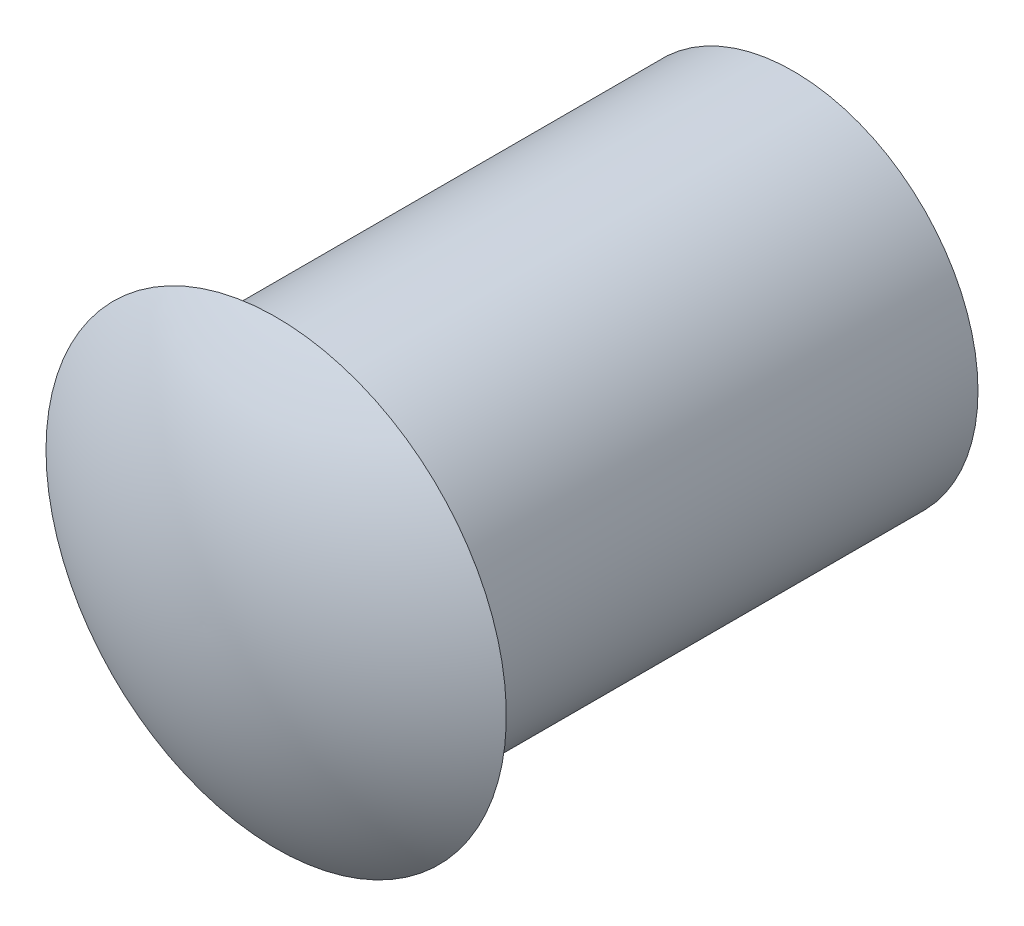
SolidWorks part; units mm, degrees
ref_plane "Front Plane" through (0, 0, 0) normal (0, 0, 1) x (1, 0, 0)
ref_plane "Top Plane" through (0, 0, 0) normal (0, 1, 0) x (1, 0, 0)
ref_plane "Right Plane" through (0, 0, 0) normal (1, 0, 0) x (0, 0, -1)
sketch "Sketch1" plane through (0, 0, 0) normal (0, 0, 1) x (1, 0, 0)
  circle A0 centre (0, 0) radius 2.9925
extrude "Boss-Extrude1" add sketch "Sketch1" against normal blind 8.382
sketch "Sketch2" plane through (0, 0, 0) normal (0, 1, 0) x (1, 0, 0)
  line L0 (-3.7303, 0) -> (0, 0)
  line L1 (0, 0) -> (0, -1.1808)
  arc A0 (0, -1.1808) -> (-3.7303, 0) centre (-0.0452, 5.159) cw
revolve "Revolve1" add sketch "Sketch2" angle 360 about L1
